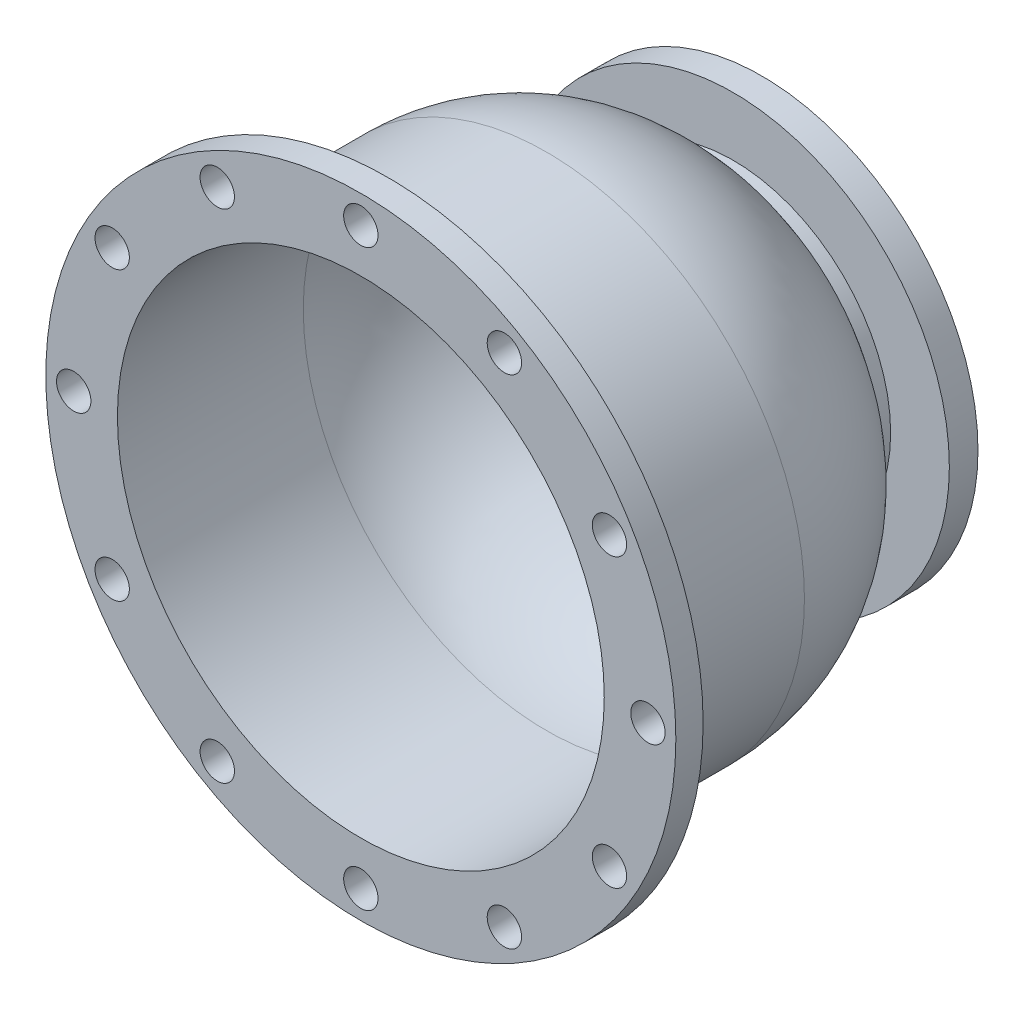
SolidWorks part; units mm, degrees
ref_plane "Alzado" through (0, 0, 0) normal (0, 0, 1) x (1, 0, 0)
ref_plane "Planta" through (0, 0, 0) normal (0, 1, 0) x (1, 0, 0)
ref_plane "Vista lateral" through (0, 0, 0) normal (1, 0, 0) x (0, 0, -1)
sketch "Croquis1" plane through (0, 0, 0) normal (1, 0, 0) x (0, 0, -1)
  line L0 (0, 220) -> (0, 170)
  line L1 (0, 170) -> (129.8, 170)
  line L2 (249.8, 50) -> (304, 50)
  line L3 (304, 50) -> (304, 110)
  line L4 (304, 110) -> (280, 110)
  line L5 (280, 110) -> (280, 151)
  line L6 (280, 151) -> (260, 151)
  line L7 (260, 151) -> (260, 110)
  line L8 (260, 110) -> (249.8, 110)
  line L9 (0, 220) -> (19.05, 220)
  line L10 (19.05, 220) -> (19.05, 180)
  line L11 (19.05, 180) -> (129.8, 180)
  line L12 (0, 0) -> (304, 0) construction
  arc A0 (129.8, 170) -> (249.8, 50) centre (129.8, 50) cw
  arc A1 (129.8, 180) -> (249.8, 110) centre (129.8, 42.1429) cw
  dimension "D1" = 440
  dimension "D2" = 340
  dimension "D3" = 360
  dimension "D4" = 19.05
  dimension "D5" = 100
  dimension "D6" = 220
  dimension "D7" = 20
  dimension "D8" = 24
  dimension "D9" = 54.2
  dimension "D10" = 302
  dimension "D11" = 304
revolve "Revolución1" add sketch "Croquis1" angle 360 about L12
hole_wizard "Taladro de margen para M201" positions "Croquis3" profile "Croquis4" hole size "M20" standard "Ansi Metric"
sketch "Croquis3" plane through (0, 0, -19.05) normal (0, 0, -1) x (-1, 0, 0)
  circle A0 centre (0, 0) radius 200.5 construction
  point P0 (0, -200.5)
  dimension "D1" = 401
sketch "Croquis4" plane through (0, -200.5, -19.05) normal (1, 0, 0) x (0, 1, 0)
  line L0 (0, 0) -> (0, 19.05)
  line L1 (0, 19.05) -> (12, 19.05)
  line L2 (12, 19.05) -> (12, 0)
  line L5 (12, 0) -> (0, 0)
  line L11 (0, -6.35) -> (0, 107.95) construction
  dimension "Diámetro de taladro hasta el siguiente" = 24
  dimension "Profundidad de taladro hasta el siguiente" = 19.05
pattern_circular "MatrizC1" count 12 over 360 about axis through (0, 0, 0) along (0, 0, 1) of "Taladro de margen para M201"
